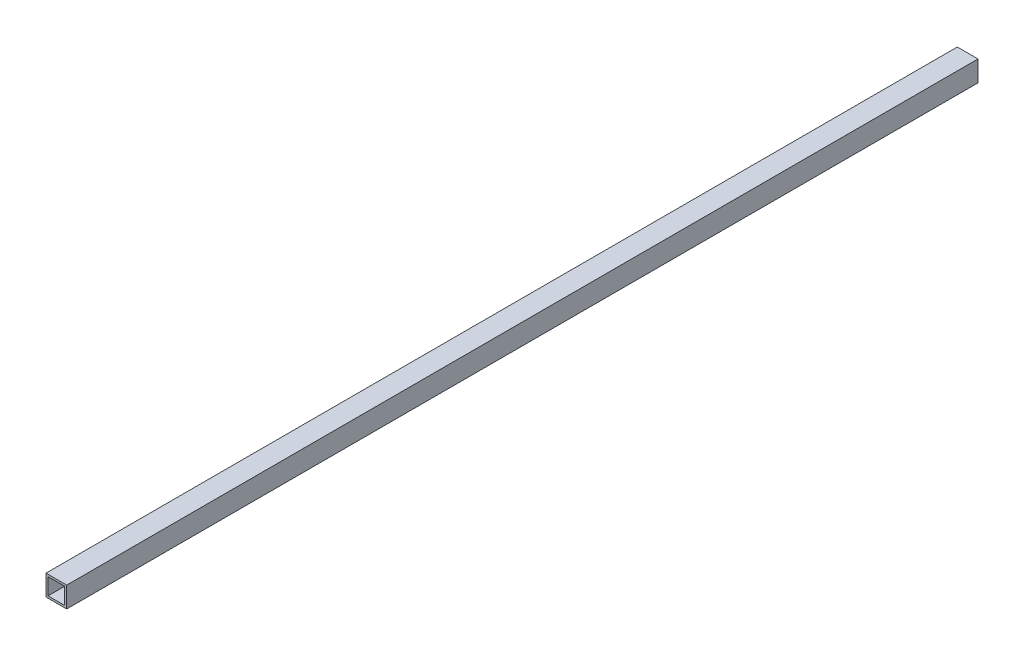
SolidWorks part; units mm, degrees
ref_plane "Plan de face" through (0, 0, 0) normal (0, 0, 1) x (1, 0, 0)
ref_plane "Plan de dessus" through (0, 0, 0) normal (0, 1, 0) x (1, 0, 0)
ref_plane "Plan de droite" through (0, 0, 0) normal (1, 0, 0) x (0, 0, -1)
sketch "Esquisse1" plane through (0, 0, 0) normal (0, 0, 1) x (1, 0, 0)
  line L0 (-5, 45) -> (-45, 45)
  line L1 (0, 0) -> (-50, 0)
  line L2 (0, 0) -> (0, 50)
  line L3 (0, 50) -> (-50, 50)
  line L4 (-50, 0) -> (-50, 50)
  line L5 (-45, 5) -> (-45, 45)
  line L6 (-5, 5) -> (-45, 5)
  line L7 (-5, 5) -> (-5, 45)
  dimension "D1" = 50
  dimension "D2" = 50
  dimension "D3" = 5
extrude "Boss.-Extru.1" add sketch "Esquisse1" along normal blind 2200
